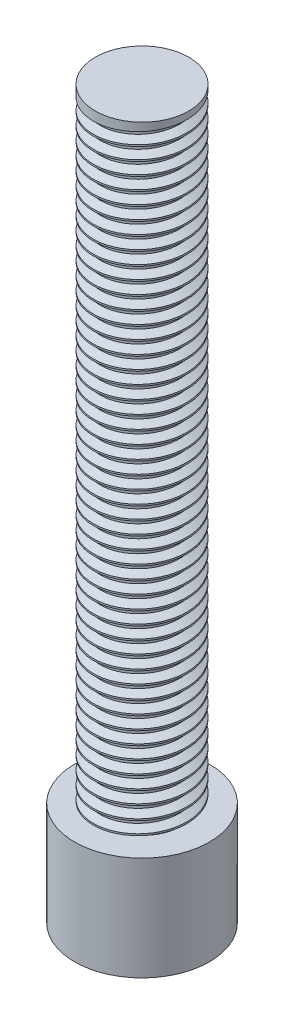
SolidWorks part; units mm, degrees
ref_plane "Front Plane" through (0, 0, 0) normal (0, 0, 1) x (1, 0, 0)
ref_plane "Top Plane" through (0, 0, 0) normal (0, 1, 0) x (1, 0, 0)
ref_plane "Right Plane" through (0, 0, 0) normal (1, 0, 0) x (0, 0, -1)
sketch "Sketch8" plane through (0, 0, 0) normal (0, 1, 0) x (1, 0, 0)
  circle A0 centre (0, 0) radius 4.5
  dimension "D1" = 9
extrude "Boss-Extrude1" add sketch "Sketch8" along normal blind 60
thread "Thread1" pitch 1.25 start angle 0, offset 0, length 60, pitch 1.25, diameter 9
ref_plane "Plane1" through (-4.5, 60, 0) normal (0, 0, 1) x (-1, 0, 0)
sketch "Thread Profile1" plane through (-4.5, 60, 0) normal (0, 0, 1) x (-1, 0, 0)
  line L0 (0, 0) -> (0, 1.25) construction
  line L11 (0, 0) -> (0, 1.0937)
  line L12 (0, 1.0937) -> (-0.6766, 0.7031)
  line L13 (-0.6766, 0.7031) -> (-0.6766, 0.3906)
  line L15 (-0.6766, 0.3906) -> (0, 0)
  line L17 (-0.6766, 0.5469) -> (0, 0.5469) construction
  point P2 (0, 0)
  dimension "Pitch" = 1.25
  dimension "Profile_Angle" = 60
  dimension "Profile_Land" = 0.3125
  dimension "Profile_Height" = 0.6766
sketch "Sketch9" plane through (0, 0, 0) normal (0, -1, 0) x (-1, 0, 0)
  circle A0 centre (0, 0) radius 6.5
  dimension "D1" = 13
extrude "Boss-Extrude2" add sketch "Sketch9" along normal blind 10
